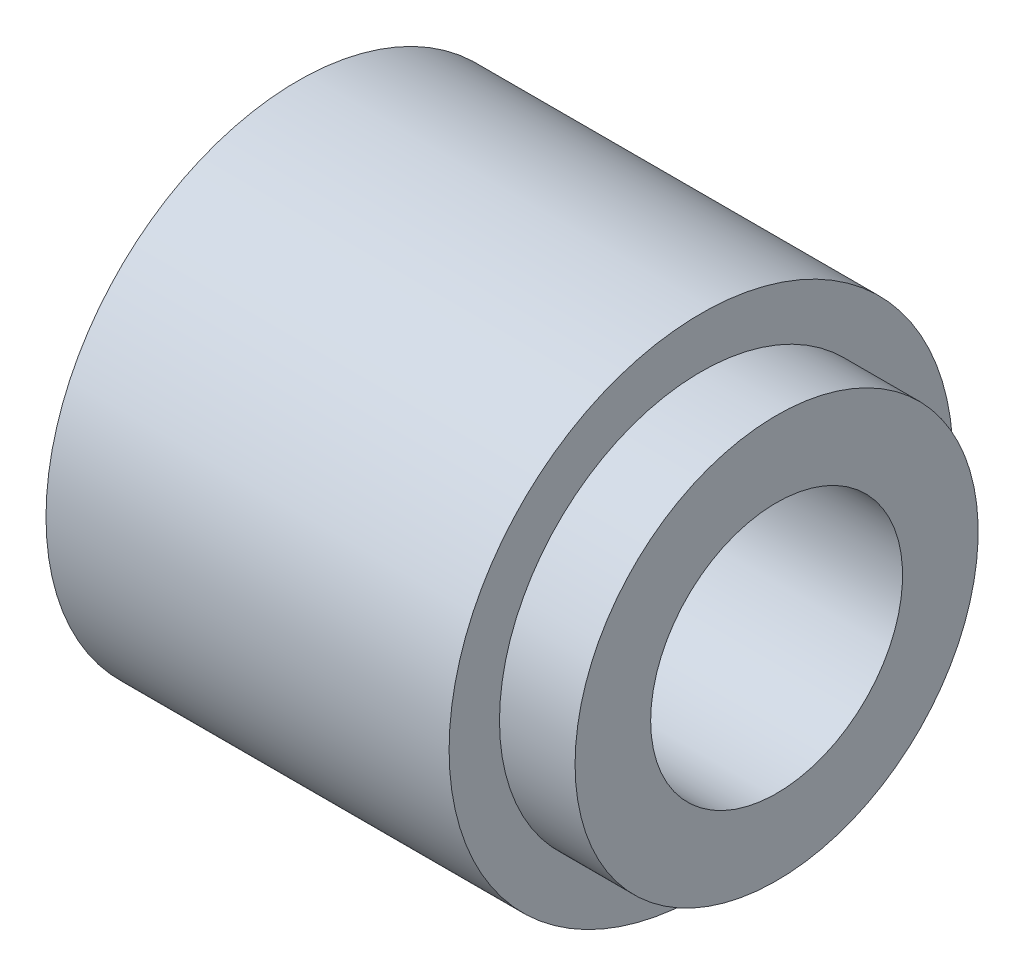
SolidWorks part; units mm, degrees
ref_plane "Front" through (0, 0, 0) normal (0, 0, 1) x (1, 0, 0)
ref_plane "Top" through (0, 0, 0) normal (0, 1, 0) x (1, 0, 0)
ref_plane "Right" through (0, 0, 0) normal (1, 0, 0) x (0, 0, -1)
sketch "Sketch1" plane through (0, 0, 0) normal (0, 0, 1) x (1, 0, 0)
  line L0 (0, 0) -> (9.5, 0)
  line L1 (9.5, 2.5) -> (9.5, 4)
  line L2 (9.5, 4) -> (8, 4)
  line L3 (8, 4) -> (8, 5)
  line L4 (8, 5) -> (0, 5)
  line L5 (0, 5) -> (0, 2.5)
  line L6 (0, 2.5) -> (9.5, 2.5)
revolve "Revolve1" add sketch "Sketch1" angle 360 about L0
